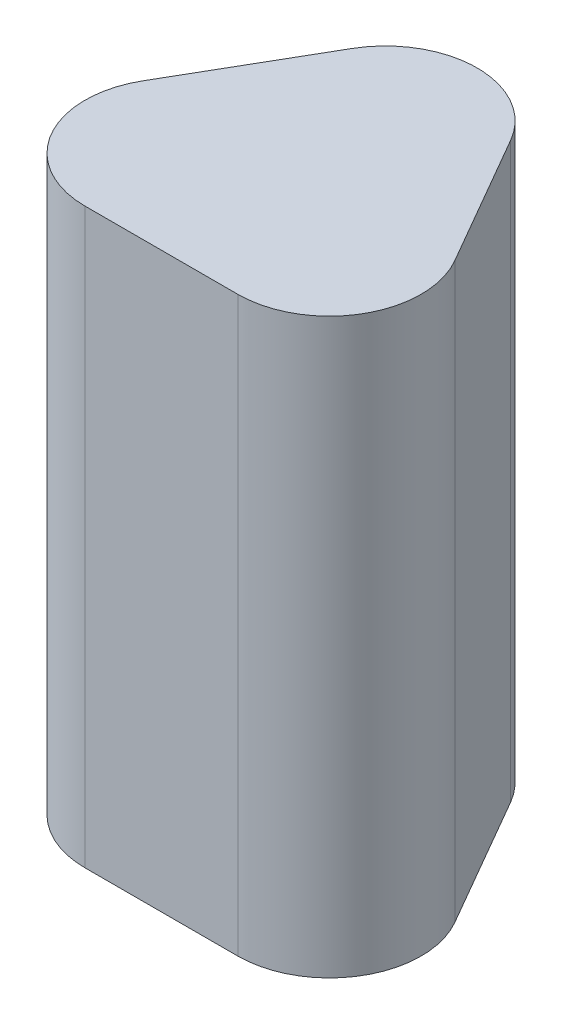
SolidWorks part; units mm, degrees
ref_plane "Спереди" through (0, 0, 0) normal (0, 0, 1) x (1, 0, 0)
ref_plane "Сверху" through (0, 0, 0) normal (0, 1, 0) x (1, 0, 0)
ref_plane "Справа" through (0, 0, 0) normal (1, 0, 0) x (0, 0, -1)
sketch "Эскиз1" plane through (0, 0, 0) normal (0, 1, 0) x (1, 0, 0)
  line L0 (0, 0) -> (0, 11.547) construction
  line L1 (0, 0) -> (10, -5.7735) construction
  line L2 (0, 0) -> (-10, -5.7735) construction
  line L3 (10.3923, 17.547) -> (20.3923, 0.2265)
  line L4 (10, -17.7735) -> (-10, -17.7735)
  line L5 (-10.3923, 17.547) -> (-20.3923, 0.2265)
  arc A0 (-10.3923, 17.547) -> (10.3923, 17.547) centre (0, 11.547) cw
  arc A1 (20.3923, 0.2265) -> (10, -17.7735) centre (10, -5.7735) cw
  arc A2 (-20.3923, 0.2265) -> (-10, -17.7735) centre (-10, -5.7735) ccw
  dimension "D1" = 12
  dimension "D5" = 41.3205
  dimension "D6" = 44
  dimension "D2" = 120
  dimension "D3" = 120
  dimension "D4" = 20
extrude "Бобышка-Вытянуть1" add sketch "Эскиз1" along normal blind 75
sketch "Эскиз2" plane through (0, 0, 0) normal (0, -1, 0) x (1, 0, 0)
  line L0 (-10, 15.2735) -> (10, 15.2735)
  line L1 (18.2272, 1.0235) -> (8.2272, -16.297)
  line L2 (-18.2272, 1.0235) -> (-8.2272, -16.297)
  arc A0 (18.2272, 1.0235) -> (10, 15.2735) centre (10, 5.7735) ccw
  arc A1 (-10, 15.2735) -> (-18.2272, 1.0235) centre (-10, 5.7735) ccw
  arc A2 (-8.2272, -16.297) -> (8.2272, -16.297) centre (0, -11.547) ccw
  arc A3 (20.3923, -0.2265) -> (10, 17.7735) centre (10, 5.7735) ccw construction
  arc A4 (-10, 17.7735) -> (-20.3923, -0.2265) centre (-10, 5.7735) ccw construction
  arc A5 (-10.3923, -17.547) -> (10.3923, -17.547) centre (0, -11.547) ccw construction
  dimension "D1" = 19
extrude "Вырез-Вытянуть1" cut sketch "Эскиз2" against normal offset from surface (72 mm away) 3
sketch "Эскиз3" plane through (0, 0, 0) normal (0, -1, 0) x (1, 0, 0)
  line L6 (9.3098, -16.922) -> (19.3098, 0.3985)
  line L7 (-19.3098, 0.3985) -> (-9.3098, -16.922)
  line L8 (10, 16.5235) -> (-10, 16.5235)
  line L9 (9.3098, -16.922) -> (19.3098, 0.3985)
  line L10 (-19.3098, 0.3985) -> (-9.3098, -16.922)
  line L11 (10, 16.5235) -> (-10, 16.5235)
  arc A6 (-9.3098, -16.922) -> (9.3098, -16.922) centre (0, -11.547) ccw
  arc A7 (-10, 16.5235) -> (-19.3098, 0.3985) centre (-10, 5.7735) ccw
  arc A8 (19.3098, 0.3985) -> (10, 16.5235) centre (10, 5.7735) ccw
  arc A9 (-9.3098, -16.922) -> (9.3098, -16.922) centre (0, -11.547) ccw
  arc A10 (-10, 16.5235) -> (-19.3098, 0.3985) centre (-10, 5.7735) ccw
  arc A11 (19.3098, 0.3985) -> (10, 16.5235) centre (10, 5.7735) ccw
  dimension "D1" = 1.25
extrude "Вырез-Вытянуть2" cut sketch "Эскиз3" against normal blind 2.5
sketch "Эскиз4" plane through (0, 72, 0) normal (0, -1, 0) x (1, 0, 0)
  line L0 (0, 15.2735) -> (0, 0) construction
  line L1 (-10, 15.2735) -> (10, 15.2735) construction
  line L2 (0, 0) -> (13.2272, -7.6368) construction
  line L3 (18.2272, 1.0235) -> (8.2272, -16.297) construction
  line L4 (0, 0) -> (-13.2272, -7.6368) construction
  line L5 (-8.2272, -16.297) -> (-18.2272, 1.0235) construction
  circle A0 centre (0, 12) radius 2.6
  circle A1 centre (-10.3923, -6) radius 2.6
  circle A2 centre (10.3923, -6) radius 2.6
  circle A6 centre (0, 0) radius 12 construction
  dimension "D1" = 5.2
  dimension "D2" = 24
extrude "Вырез-Вытянуть3" cut sketch "Эскиз4" against normal blind 2
